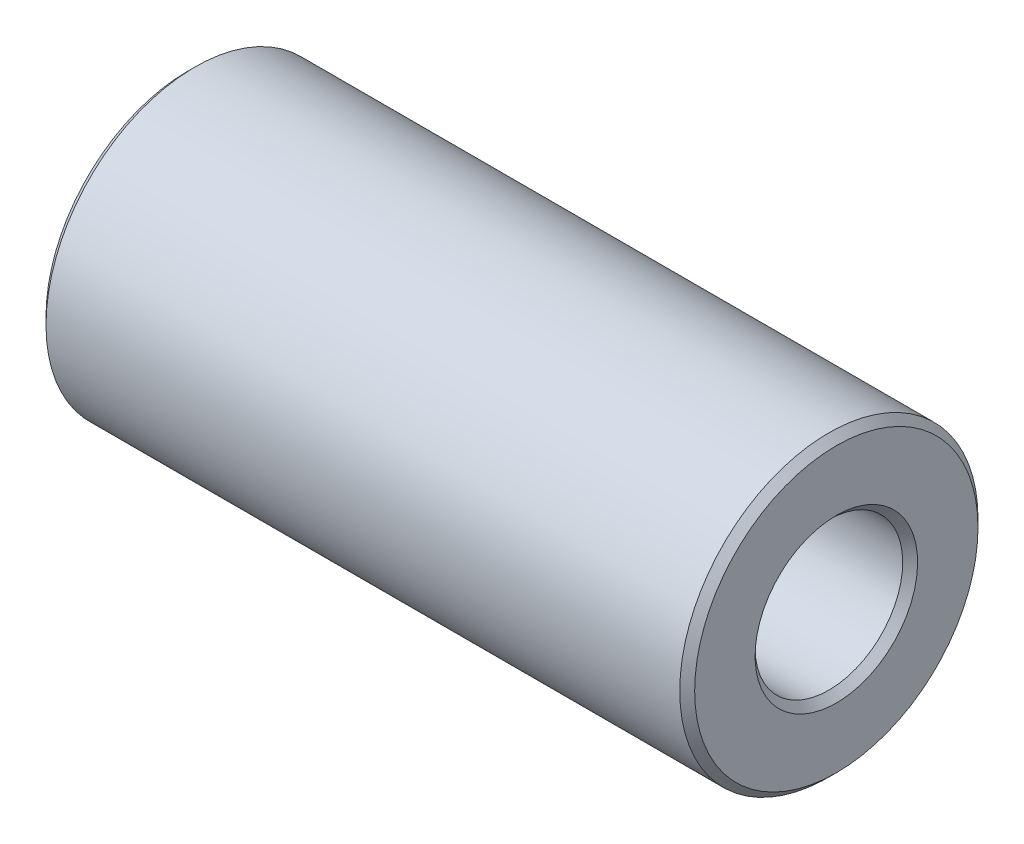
SolidWorks part; units mm, degrees
ref_plane "Plan de face" through (0, 0, 0) normal (0, 0, 1) x (1, 0, 0)
ref_plane "Plan de dessus" through (0, 0, 0) normal (0, 1, 0) x (1, 0, 0)
ref_plane "Plan de droite" through (0, 0, 0) normal (1, 0, 0) x (0, 0, -1)
imported_body "Importée1"
sketch "Esquisse2" plane through (57.37, 0, 0) normal (-1, 0, 0) x (0, 0, 1)
  circle A0 centre (0, 0) radius 9.5
  circle A1 centre (0, 0) radius 9.5 construction
  circle A2 centre (0, 0) radius 4.95
  circle A3 centre (0, 0) radius 4.95 construction
extrude "Extrusion1" add sketch "Esquisse2" against normal blind 3
sketch "Esquisse4" plane through (57.37, 0, 0) normal (-1, 0, 0) x (0, 0, 1)
  circle A0 centre (0, 0) radius 10
  circle A1 centre (0, 0) radius 4.95
  dimension "D1" = 20
extrude "Extrusion2" add sketch "Esquisse4" against normal up to surface (37 mm away)
sketch "Esquisse6" plane through (57.37, 0, 0) normal (-1, 0, 0) x (0, 0, 1)
  circle A0 centre (0, 0) radius 4.95 construction
  circle A1 centre (0, 0) radius 10
  circle A2 centre (0, 0) radius 10
  circle A3 centre (0, 0) radius 4.95
  dimension "D1" = 0
extrude "Boss.-Extru.1" add sketch "Esquisse6" along normal blind 1.5
sketch "Esquisse5" plane through (0, 0, 0) normal (0, 0, 1) x (1, 0, 0)
  line L0 (94.37, 10) -> (55.87, 10) construction
  line L1 (87.2037, 15.3563) -> (103.5825, 15.3563)
  line L2 (87.2037, 15.3563) -> (87.2037, 10)
  line L3 (87.2037, 10) -> (103.5825, 10)
  line L4 (103.5825, 15.3563) -> (103.5825, 10)
  line L5 (99.37, 0) -> (49.2671, 0) construction
  line L6 (99.37, -11.5) -> (99.37, 11.5) construction
revolve "Enlèvement de matière-Révolution1" cut sketch "Esquisse5" angle 360 about L5
chamfer "Chanfrein1" distance 0.5 angle 45 3 edges at (99.37, 0, -10) (55.87, 0, 4.95) (55.87, 0, 10)
